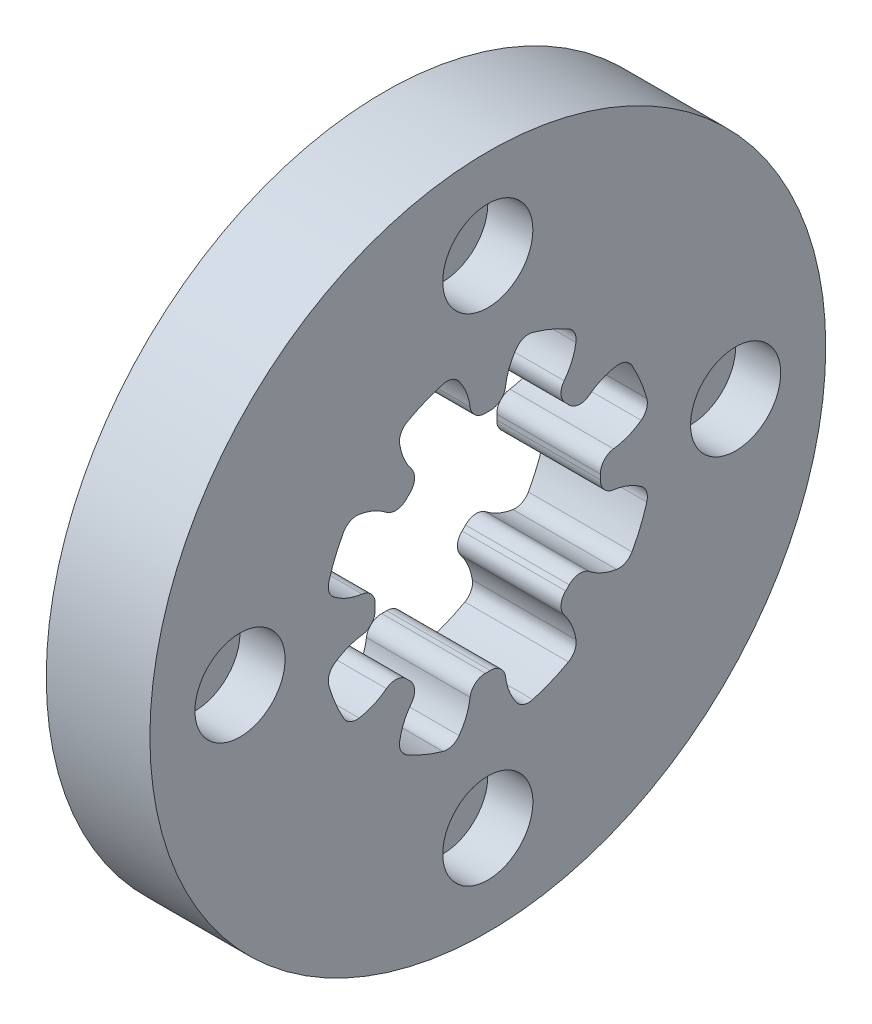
SolidWorks part; units mm, degrees
ref_plane "Plane1" through (0, 0, 0) normal (0, 0, 1) x (1, 0, 0)
ref_plane "Plane2" through (0, 0, 0) normal (0, 1, 0) x (1, 0, 0)
ref_plane "Plane3" through (0, 0, 0) normal (1, 0, 0) x (0, 0, -1)
other "Configuration Table"
sketch "HoldingSke" plane through (0, 0, 0) normal (0, 1, 0) x (1, 0, 0)
  line L0 (0, 0) -> (0.4924, -0.0868)
  line L1 (-15, 0) -> (100, 0) construction
  line L2 (0, 0) -> (-2.1039, 2.3779)
  line L3 (0, 0) -> (-11.863, 4.5341)
  line L4 (0, 0) -> (8.5048, 1.4996)
  line L5 (0, 0) -> (-46.8476, -17.4728)
  line L6 (0, 0) -> (-5.1396, -3.4677)
  line L7 (-2.1039, 2.3779) -> (8.6586, 51.2059)
  line L8 (-76.2, 54.61) -> (-75.7, 54.61)
  line L9 (-71.009, 38.7566) -> (-53.1078, 45.2721)
  line L10 (-76.2, 71.12) -> (104.1128, 71.12)
  line L11 (0, 0) -> (-6.2, 0)
  line L12 (-76.2, 101.6) -> (-76.133, 101.6)
  line L13 (24.9733, 27.94) -> (52.9518, 28.4284)
  line L14 (24.9733, 27.94) -> (24.9743, 27.94)
  line L15 (24.9733, 27.94) -> (100.4006, 29.5858)
  line L16 (-63.627, -2) -> (-12.827, -2)
  circle A0 centre (0, 0) radius 1.5
  circle A1 centre (0, 0) radius 7.499
  circle A2 centre (0, 0) radius 37.5
  circle A3 centre (0, 0) radius 1.5
sketch "BasProSke" plane through (0, 0, 0) normal (0, 1, 0) x (1, 0, 0)
  line L0 (-10, 0) -> (60, 0) construction
  line L1 (0, 0) -> (0, 11)
  line L2 (0, 0) -> (7, 0)
  line L3 (7, 0) -> (7, 11)
  line L4 (7, 11) -> (0, 11)
revolve "Base-Revolve" add sketch "BasProSke" angle 360 about L0
sketch "TooCutSke" plane through (0, 0, 0) normal (1, 0, 0) x (0, 0, -1)
  line L1 (0, 0) -> (0, 107) construction
  line L2 (0, 0) -> (-1.6814, 9.8576) construction
  line L3 (0, 0) -> (-6.1153, 18.8209) construction
  line L4 (-1.6814, 9.8576) -> (-3.0576, 9.4105) construction
  arc A0 (1.1737, 7.4066) -> (-1.1737, 7.4066) centre (0, 0) ccw
  arc A1 (3.4979, 11.5054) -> (-3.4979, 11.5054) centre (0, 0) ccw
  circle A2 centre (0, 0) radius 10 construction
  circle A3 centre (0, 0) radius 9.3969 construction
  arc A4 (-1.1737, 7.4066) -> (-3.4979, 11.5054) centre (-5.1477, 7.8615) ccw
  arc A5 (3.4979, 11.5054) -> (1.1737, 7.4066) centre (5.1477, 7.8615) ccw
extrude "ToothCut" cut sketch "TooCutSke" along normal through all
fillet "Breaks" [suppressed] radius 0.04
fillet "RootFillets" [suppressed] radius 0.501
pattern_circular "TeethCuts" count 8 over 360 about axis through (0, 0, 0) along (1, 0, 0) of "ToothCut"
sketch "HubNeaOneSke" plane through (0, 0, 0) normal (-1, 0, 0) x (0, 0, 1)
  circle A0 centre (0, 0) radius 7.499
extrude "HubNearOne" [suppressed] add sketch "HubNeaOneSke" along normal blind 43.0001
sketch "HubNeaBotSke" plane through (0, 0, 0) normal (-1, 0, 0) x (0, 0, 1)
  circle A0 centre (0, 0) radius 7.499
extrude "HubNearBoth" [suppressed] add sketch "HubNeaBotSke" along normal blind 21.5
ref_plane "FarPln" through (7, 0, 0) normal (1, 0, 0) x (0, 0, -1)
sketch "HubFarSke" plane through (7, 0, 0) normal (1, 0, 0) x (0, 0, -1)
  circle A0 centre (0, 0) radius 7.499
extrude "HubFar" [suppressed] add sketch "HubFarSke" along normal blind 21.5
sketch "BorSke" plane through (0, 0, 0) normal (1, 0, 0) x (0, 0, -1)
  circle A0 centre (0, 0) radius 1.5
extrude "Bore" cut sketch "BorSke" along normal mid plane 100.0001
sketch "KeySke" plane through (0, 0, 0) normal (1, 0, 0) x (0, 0, -1)
  line L0 (-0.6, 0) -> (-0.6, 2)
  line L1 (-0.6, 2) -> (0.6, 2)
  line L2 (0.6, 2) -> (0.6, 0)
  line L3 (0, 0) -> (0, 34) construction
  line L4 (-0.6, 0) -> (0.6, 0)
extrude "Keyway" [suppressed] cut sketch "KeySke" along normal mid plane 100.0001
pattern_circular "Keyway2" [suppressed] count 2 every 90 about axis through (-10, 0, 0) along (1, 0, 0)
sketch "Sketch2" plane through (7, 0, 0) normal (1, 0, 0) x (0, 0, -1)
  circle A0 centre (0, 0) radius 22.5
  dimension "D1" = 45
extrude "Boss-Extrude2" add sketch "Sketch2" against normal blind 6.9
sketch "Sketch3" plane through (0, 0, 0) normal (-1, 0, 0) x (0, 0, 1)
  arc A32 (7.4066, 1.1737) -> (10.7413, 2.3716) centre (7.8615, 5.1477) ccw
  arc A33 (10.7413, 2.3716) -> (9.2722, 5.9183) centre (0, 0) ccw
  arc A34 (9.2722, 5.9183) -> (6.0672, 4.4073) centre (9.1989, 1.9189) ccw
  arc A35 (6.0672, 4.4073) -> (4.4073, 6.0672) centre (0, 0) ccw
  arc A36 (4.4073, 6.0672) -> (5.9183, 9.2722) centre (1.9189, 9.1989) ccw
  arc A37 (5.9183, 9.2722) -> (2.3716, 10.7413) centre (0, 0) ccw
  arc A38 (2.3716, 10.7413) -> (1.1737, 7.4066) centre (5.1477, 7.8615) ccw
  arc A39 (1.1737, 7.4066) -> (-1.1737, 7.4066) centre (0, 0) ccw
  arc A40 (-1.1737, 7.4066) -> (-2.3716, 10.7413) centre (-5.1477, 7.8615) ccw
  arc A41 (-2.3716, 10.7413) -> (-5.9183, 9.2722) centre (0, 0) ccw
  arc A42 (-5.9183, 9.2722) -> (-4.4073, 6.0672) centre (-1.9189, 9.1989) ccw
  arc A43 (-4.4073, 6.0672) -> (-6.0672, 4.4073) centre (0, 0) ccw
  arc A44 (-6.0672, 4.4073) -> (-9.2722, 5.9183) centre (-9.1989, 1.9189) ccw
  arc A45 (-9.2722, 5.9183) -> (-10.7413, 2.3716) centre (0, 0) ccw
  arc A46 (-10.7413, 2.3716) -> (-7.4066, 1.1737) centre (-7.8615, 5.1477) ccw
  arc A47 (-7.4066, 1.1737) -> (-7.4066, -1.1737) centre (0, 0) ccw
  arc A48 (-7.4066, -1.1737) -> (-10.7413, -2.3716) centre (-7.8615, -5.1477) ccw
  arc A49 (-10.7413, -2.3716) -> (-9.2722, -5.9183) centre (0, 0) ccw
  arc A50 (-9.2722, -5.9183) -> (-6.0672, -4.4073) centre (-9.1989, -1.9189) ccw
  arc A51 (-6.0672, -4.4073) -> (-4.4073, -6.0672) centre (0, 0) ccw
  arc A52 (-4.4073, -6.0672) -> (-5.9183, -9.2722) centre (-1.9189, -9.1989) ccw
  arc A53 (-5.9183, -9.2722) -> (-2.3716, -10.7413) centre (0, 0) ccw
  arc A54 (-2.3716, -10.7413) -> (-1.1737, -7.4066) centre (-5.1477, -7.8615) ccw
  arc A55 (-1.1737, -7.4066) -> (1.1737, -7.4066) centre (0, 0) ccw
  arc A56 (1.1737, -7.4066) -> (2.3716, -10.7413) centre (5.1477, -7.8615) ccw
  arc A57 (2.3716, -10.7413) -> (5.9183, -9.2722) centre (0, 0) ccw
  arc A58 (5.9183, -9.2722) -> (4.4073, -6.0672) centre (1.9189, -9.1989) ccw
  arc A59 (4.4073, -6.0672) -> (6.0672, -4.4073) centre (0, 0) ccw
  arc A60 (6.0672, -4.4073) -> (9.2722, -5.9183) centre (9.1989, -1.9189) ccw
  arc A61 (9.2722, -5.9183) -> (10.7413, -2.3716) centre (0, 0) ccw
  arc A62 (10.7413, -2.3716) -> (7.4066, -1.1737) centre (7.8615, -5.1477) ccw
  arc A63 (7.4066, -1.1737) -> (7.4066, 1.1737) centre (0, 0) ccw
  arc A64 (7.4066, 1.1737) -> (10.7413, 2.3716) centre (7.8615, 5.1477) ccw
  arc A65 (10.7413, 2.3716) -> (9.2722, 5.9183) centre (0, 0) ccw
  arc A66 (9.2722, 5.9183) -> (6.0672, 4.4073) centre (9.1989, 1.9189) ccw
  arc A67 (6.0672, 4.4073) -> (4.4073, 6.0672) centre (0, 0) ccw
  arc A68 (4.4073, 6.0672) -> (5.9183, 9.2722) centre (1.9189, 9.1989) ccw
  arc A69 (5.9183, 9.2722) -> (2.3716, 10.7413) centre (0, 0) ccw
  arc A70 (2.3716, 10.7413) -> (1.1737, 7.4066) centre (5.1477, 7.8615) ccw
  arc A71 (1.1737, 7.4066) -> (-1.1737, 7.4066) centre (0, 0) ccw
  arc A72 (-1.1737, 7.4066) -> (-2.3716, 10.7413) centre (-5.1477, 7.8615) ccw
  arc A73 (-2.3716, 10.7413) -> (-5.9183, 9.2722) centre (0, 0) ccw
  arc A74 (-5.9183, 9.2722) -> (-4.4073, 6.0672) centre (-1.9189, 9.1989) ccw
  arc A75 (-4.4073, 6.0672) -> (-6.0672, 4.4073) centre (0, 0) ccw
  arc A76 (-6.0672, 4.4073) -> (-9.2722, 5.9183) centre (-9.1989, 1.9189) ccw
  arc A77 (-9.2722, 5.9183) -> (-10.7413, 2.3716) centre (0, 0) ccw
  arc A78 (-10.7413, 2.3716) -> (-7.4066, 1.1737) centre (-7.8615, 5.1477) ccw
  arc A79 (-7.4066, 1.1737) -> (-7.4066, -1.1737) centre (0, 0) ccw
  arc A80 (-7.4066, -1.1737) -> (-10.7413, -2.3716) centre (-7.8615, -5.1477) ccw
  arc A81 (-10.7413, -2.3716) -> (-9.2722, -5.9183) centre (0, 0) ccw
  arc A82 (-9.2722, -5.9183) -> (-6.0672, -4.4073) centre (-9.1989, -1.9189) ccw
  arc A83 (-6.0672, -4.4073) -> (-4.4073, -6.0672) centre (0, 0) ccw
  arc A84 (-4.4073, -6.0672) -> (-5.9183, -9.2722) centre (-1.9189, -9.1989) ccw
  arc A85 (-5.9183, -9.2722) -> (-2.3716, -10.7413) centre (0, 0) ccw
  arc A86 (-2.3716, -10.7413) -> (-1.1737, -7.4066) centre (-5.1477, -7.8615) ccw
  arc A87 (-1.1737, -7.4066) -> (1.1737, -7.4066) centre (0, 0) ccw
  arc A88 (1.1737, -7.4066) -> (2.3716, -10.7413) centre (5.1477, -7.8615) ccw
  arc A89 (2.3716, -10.7413) -> (5.9183, -9.2722) centre (0, 0) ccw
  arc A90 (5.9183, -9.2722) -> (4.4073, -6.0672) centre (1.9189, -9.1989) ccw
  arc A91 (4.4073, -6.0672) -> (6.0672, -4.4073) centre (0, 0) ccw
  arc A92 (6.0672, -4.4073) -> (9.2722, -5.9183) centre (9.1989, -1.9189) ccw
  arc A93 (9.2722, -5.9183) -> (10.7413, -2.3716) centre (0, 0) ccw
  arc A94 (10.7413, -2.3716) -> (7.4066, -1.1737) centre (7.8615, -5.1477) ccw
  arc A95 (7.4066, -1.1737) -> (7.4066, 1.1737) centre (0, 0) ccw
  dimension "D1" = 0
extrude "Cut-Extrude1" cut sketch "Sketch3" against normal through all
fillet "Fillet1" radius 1 32 edges at (3.55, -5.9183, -9.2722) (3.55, -2.3716, -10.7413) (3.55, 1.1737, -7.4066) (3.55, 2.3716, -10.7413) (3.55, -4.4073, -6.0672) (3.55, -9.2722, -5.9183) (3.55, -10.7413, -2.3716) (3.55, -7.4066, -1.1737) (3.55, -7.4066, 1.1737) (3.55, -10.7413, 2.3716) (3.55, -5.9183, 9.2722) (3.55, -9.2722, 5.9183) (3.55, -4.4073, 6.0672) (3.55, -2.3716, 10.7413) (3.55, 1.1737, 7.4066) (3.55, 2.3716, 10.7413) (3.55, 9.2722, 5.9183) (3.55, 5.9183, 9.2722) (3.55, 5.9183, -9.2722) (3.55, 4.4073, -6.0672) (3.55, -1.1737, -7.4066) (3.55, -6.0672, -4.4073) (3.55, -6.0672, 4.4073) (3.55, -1.1737, 7.4066) (3.55, 4.4073, 6.0672) (3.55, 6.0672, 4.4073) (3.55, 10.7413, 2.3716) (3.55, 7.4066, 1.1737) (3.55, 6.0672, -4.4073) (3.55, 9.2722, -5.9183) (3.55, 7.4066, -1.1737) (3.55, 10.7413, -2.3716)
sketch "Sketch4" plane through (7, 0, 0) normal (1, 0, 0) x (0, 0, -1)
  line L0 (0, 0) -> (0, 16.5) construction
  circle A0 centre (0, 0) radius 16.5 construction
  circle A1 centre (0, 16.5) radius 3
  dimension "D1" = 33
  dimension "D2" = 6
extrude "Cut-Extrude2" cut sketch "Sketch4" against normal blind 3 contours A1
sketch "Sketch5" plane through (4, 0, 0) normal (1, 0, 0) x (0, 0, -1)
  circle A0 centre (0, 16.5) radius 1
  circle A1 centre (0, 16.5) radius 3
  circle A2 centre (0, 16.5) radius 3 construction
  dimension "D2" = 2
  dimension "D1" = 0
extrude "Cut-Extrude3" cut sketch "Sketch5" against normal through all
pattern_circular "CirPattern1" count 4 over 360 about axis through (0, 0, 0) along (1, 0, 0) of "Cut-Extrude2", "Cut-Extrude3"
equation "' \"Module@HoldingSke\" = 6.35"
equation "' \"Num_teeth@HoldingSke\" = 12"
equation "' \"Ap@HoldingSke\" =  20"
equation "' \"Ap@HoldingSke\" = 20"
equation "' \"Width@HoldingSke\" = 0.5 * 25.4"
equation "' \"Hub_dia@HoldingSke\"= 1 * 25.4"
equation "' \"Hub_dia@HoldingSke\" = 1 * 25.4"
equation "' \"Overall_len@HoldingSke\" = 1.0 * 25.4"
equation "' \"Bore@HoldingSke\" = 0.75 * 25.4"
equation "' \"T_dim@HoldingSke\" = 0.1 * 25.4"
equation "' \"Width@KeySke\" = 0.25 * 25.4"
equation "' \"Show_teeth@HoldingSke\" = 13"
equation "' \"Backlash@HoldingSke\" = 0.009 * 25.4"
equation "' \"Addendum_fac@HoldingSke\" = 1.0"
equation "' \"Dedendum_fac@HoldingSke\" = 1.25"
equation "' \"Dedendum_add@HoldingSke\" = 0.00005 * 25.4"
equation "' \"Clearance_fac@HoldingSke\" = 0.25"
equation "\"Pitch@HoldingSke\" = 1 / \"Module@HoldingSke\""
equation "\"Overcut_dia@TooCutSke\" = (\"Num_teeth@HoldingSke\" + 2 * \"Addendum_fac@HoldingSke\") / \"Pitch@HoldingSke\" + 0.002 * 25.4"
equation "\"Pitch_dia@TooCutSke\" = \"Num_teeth@HoldingSke\" / \"Pitch@HoldingSke\""
equation "\"Base_dia@TooCutSke\" = \"Num_teeth@HoldingSke\" / \"Pitch@HoldingSke\" * cos((\"Ap@HoldingSke\"  * 3.14159265 / 180))"
equation "\"Root_dia@TooCutSke\" = (\"Num_teeth@HoldingSke\" + 2) / \"Pitch@HoldingSke\" - 2 * (\"Addendum_fac@HoldingSke\" + \"Dedendum_fac@HoldingSke\") / \"Pitch@HoldingSke\" - \"Dedendum_add@HoldingSke\" * 2"
equation "\"Half_ang@TooCutSke\" = 180 / \"Num_teeth@HoldingSke\""
equation "\"Half_CT@TooCutSke\" = \"Num_teeth@HoldingSke\" / \"Pitch@HoldingSke\" * sin((3.14159265 / 2 / \"Num_teeth@HoldingSke\")) / 2 - 7 * \"Backlash@HoldingSke\" / 4"
equation "\"Radius@RootFillets\" = \"Clearance_fac@HoldingSke\" / \"Pitch@HoldingSke\" + \"Dedendum_add@HoldingSke\""
equation "\"Break_rad@Breaks\" = 0.02 / \"Pitch@HoldingSke\""
equation "\"Thickness@HoldingSke\" = \"Width@HoldingSke\""
equation "\"OAL@HoldingSke\" = \"Thickness@HoldingSke\""
equation "\"MHD@HoldingSke\" = (\"Num_teeth@HoldingSke\" + 2) / \"Pitch@HoldingSke\" - 2 * (\"Addendum_fac@HoldingSke\" + \"Dedendum_fac@HoldingSke\")  / \"Pitch@HoldingSke\" - \"Dedendum_add@HoldingSke\" * 2"
equation "\"MBD@HoldingSke\" = (\"Num_teeth@HoldingSke\" + 2) / \"Pitch@HoldingSke\" - 2 * (\"Addendum_fac@HoldingSke\" + \"Dedendum_fac@HoldingSke\")  / \"Pitch@HoldingSke\" - \"Dedendum_add@HoldingSke\" * 2 - 0.002 * 25.4"
equation "\"MHD@HoldingSke\" = ((sgn( \"MHD@HoldingSke\" - \"Hub_dia@HoldingSke\" )-1)*( \"MHD@HoldingSke\" - \"Hub_dia@HoldingSke\" ))/-2+ \"Hub_dia@HoldingSke\""
equation "\"MBD@HoldingSke\" = ((sgn( \"MBD@HoldingSke\" - \"Bore@HoldingSke\" )-1)*( \"MBD@HoldingSke\" - \"Bore@HoldingSke\" ))/-2+ \"Bore@HoldingSke\""
equation "\"OAL@HoldingSke\" = ((sgn( \"OAL@HoldingSke\" - \"Overall_len@HoldingSke\" )+1)*( \"OAL@HoldingSke\" - \"Overall_len@HoldingSke\" ))/2 + \"Overall_len@HoldingSke\" + 0.000002 * 25.4"
equation "\"Num_teeth@TeethCuts\" = ((sgn( \"Num_teeth@TeethCuts\" - \"Num_teeth@HoldingSke\" )-1)*( \"Num_teeth@TeethCuts\" - \"Num_teeth@HoldingSke\" ))/-2+ \"Num_teeth@HoldingSke\""
equation "\"Num_teeth@TeethCuts\" = ((sgn( \"Num_teeth@TeethCuts\" - 2.0)+1)*( \"Num_teeth@TeethCuts\" - 2.0))/2 +2.0"
equation "' \"Fillet_rad@BasProSke\" =  \"Thickness@HoldingSke\" * 0.05"
equation "' \"Fillet_rad@BasProSke\" = \"Thickness@HoldingSke\" * 0.05"
equation "\"MHD@HoldingSke\" = ((sgn( \"MHD@HoldingSke\" - \"Root_dia@TooCutSke\" )-1)*( \"MHD@HoldingSke\" - \"Root_dia@TooCutSke\" ))/-2+ \"Root_dia@TooCutSke\""
equation "\"Diameter@HubNeaOneSke\" = \"MHD@HoldingSke\""
equation "\"Length@HubNearOne\" = \"OAL@HoldingSke\" - \"Thickness@BasProSke\""
equation "\"Diameter@HubNeaBotSke\" = \"MHD@HoldingSke\""
equation "\"Length@HubNearBoth\" = ( \"OAL@HoldingSke\" - \"Thickness@BasProSke\" ) / 2.0"
equation "\"Thickness@FarPln\" = \"Thickness@BasProSke\""
equation "\"Diameter@HubFarSke\" = \"MHD@HoldingSke\""
equation "\"Length@HubFar\" = ( \"OAL@HoldingSke\" - \"Thickness@BasProSke\" ) / 2.0"
equation "\"Diameter@BorSke\" = \"MBD@HoldingSke\""
equation "\"D1@Bore\" = \"OAL@HoldingSke\" * 2.0"
equation "\"D1@Keyway\" = \"OAL@HoldingSke\" * 2.0"
equation "\"Offset@KeySke\" = \"T_dim@HoldingSke\" + \"MBD@HoldingSke\" / 2.0"
